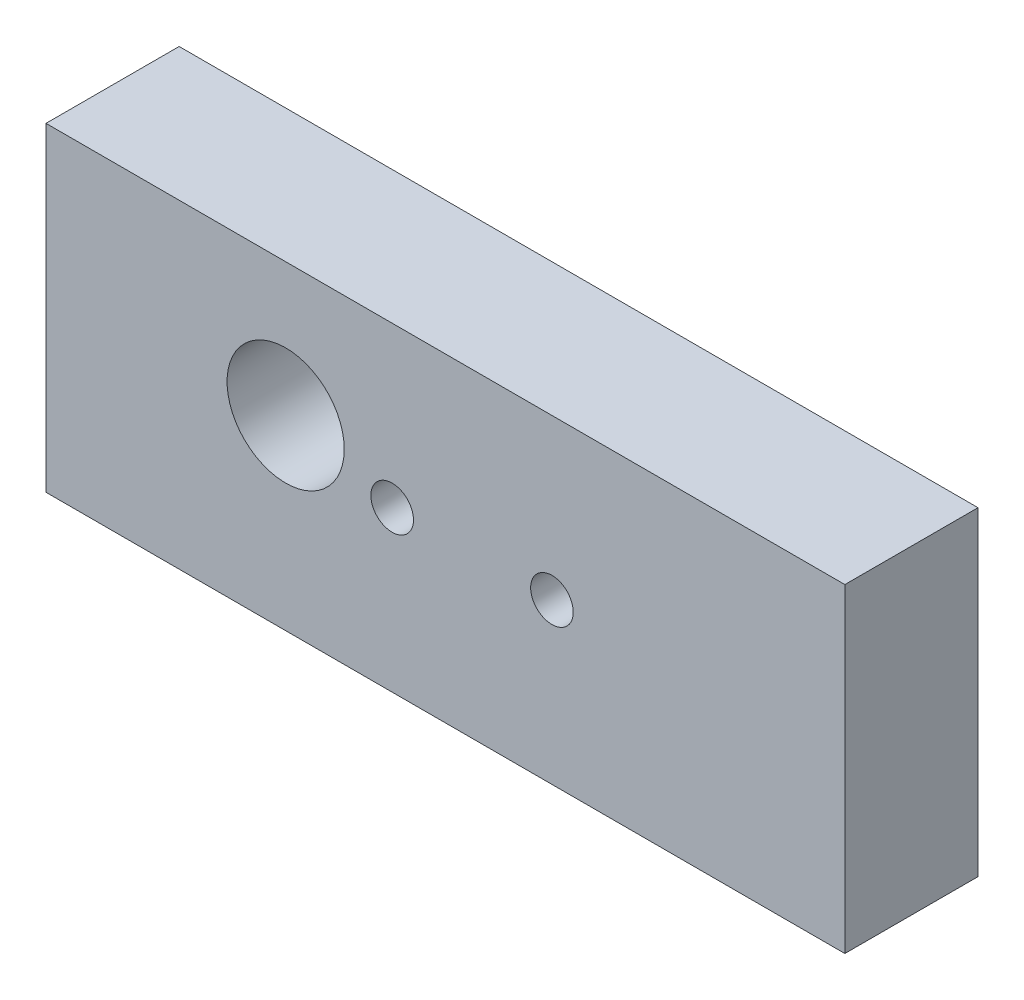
SolidWorks part; units mm, degrees
ref_plane "前视基准面" through (0, 0, 0) normal (0, 0, 1) x (1, 0, 0)
ref_plane "上视基准面" through (0, 0, 0) normal (0, 1, 0) x (1, 0, 0)
ref_plane "右视基准面" through (0, 0, 0) normal (1, 0, 0) x (0, 0, -1)
other "Configuration Table"
sketch "草图1" plane through (0, 0, 0) normal (0, 0, 1) x (1, 0, 0)
  line L1 (0, 0) -> (150, 0)
  line L2 (0, 0) -> (0, 60)
  line L3 (0, 60) -> (150, 60)
  line L4 (150, 0) -> (150, 60)
  dimension "D1" = 150
  dimension "D2" = 60
extrude "凸台-拉伸1" add sketch "草图1" against normal blind 25
sketch "草图2" plane through (0, 0, 0) normal (0, 0, 1) x (1, 0, 0)
  line L0 (0, 0) -> (45, 0) construction
  line L1 (0, 0) -> (150, 0) construction
  line L2 (45, 0) -> (45, 35) construction
  circle A0 centre (45, 35) radius 11
  dimension "D3" = 22
  dimension "D1" = 45
  dimension "D2" = 35
extrude "切除-拉伸1" cut sketch "草图2" against normal blind 20
sketch "草图3" plane through (0, 0, 0) normal (0, 0, 1) x (1, 0, 0)
  line L0 (65, 30) -> (95, 30) construction
  circle A0 centre (65, 30) radius 4
  circle A1 centre (95, 30) radius 4
  dimension "D1" = 30
extrude "切除-拉伸2" cut sketch "草图3" against normal blind 20
